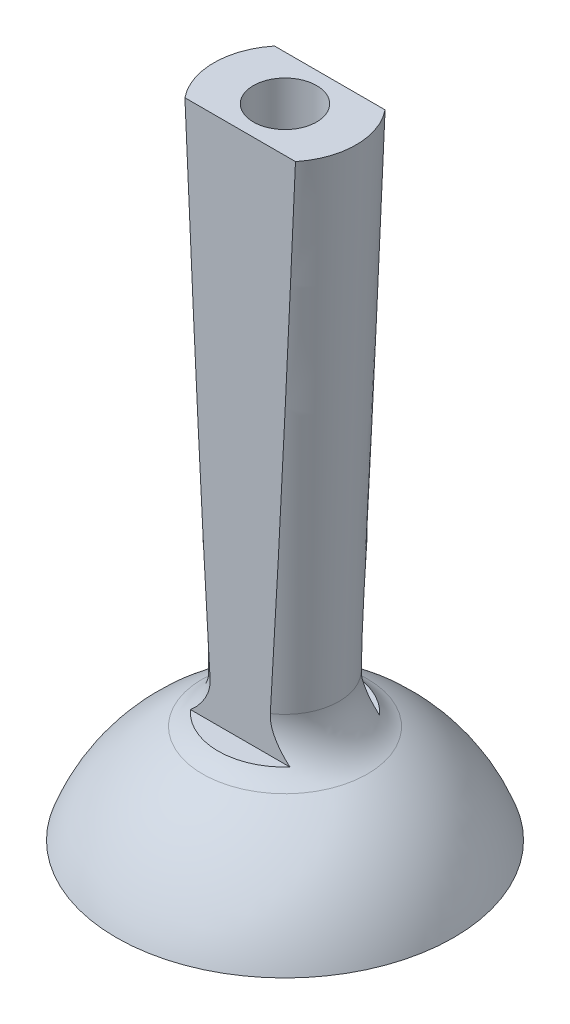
SolidWorks part; units mm, degrees
ref_plane "Спереди" through (0, 0, 0) normal (0, 0, 1) x (1, 0, 0)
ref_plane "Сверху" through (0, 0, 0) normal (0, 1, 0) x (1, 0, 0)
ref_plane "Справа" through (0, 0, 0) normal (1, 0, 0) x (0, 0, -1)
sketch "Эскиз1" plane through (0, 0, 0) normal (0, 0, 1) x (1, 0, 0)
  line L19 (-13.5, 90) -> (-10, -10)
  line L26 (-13.5, 90) -> (-6, 90)
  line L31 (-6, -8.9374) -> (-6, 90)
  line L32 (-32, -31) -> (-27, -31)
  line L33 (-6, -8.9374) -> (-6, -13.7874)
  line L34 (-27, -31) -> (-26.9845, -31)
  line L35 (0, 0) -> (0, 38.8635) construction
  arc A3 (-10, -10) -> (-32, -31) centre (0, -42.5) ccw
  arc A6 (-6, -13.7874) -> (-26.9845, -31) centre (0, -42.5) ccw
revolve "Повернуть1" add sketch "Эскиз1" angle 360 about L35
fillet "Скругление2" radius 10 1 edges at (0, -10, -10)
sketch "Эскиз2" plane through (0, 90, 0) normal (0, 1, 0) x (1, 0, 0)
  line L0 (0, 8.5) -> (19.6139, 8.5)
  line L1 (0, 0) -> (-21.4037, 0) construction
  line L2 (19.6139, 8.5) -> (19.6139, 16.0191)
  line L3 (19.6139, 16.0191) -> (-21.4037, 16.0191)
  line L4 (-21.4037, 16.0191) -> (-21.4037, 8.5)
  line L5 (-21.4037, 8.5) -> (0, 8.5)
  line L6 (-21.4037, -16.0191) -> (-21.4037, -8.5)
  line L7 (19.6139, -16.0191) -> (-21.4037, -16.0191)
  line L8 (19.6139, -8.5) -> (19.6139, -16.0191)
  line L9 (0, -8.5) -> (19.6139, -8.5)
  line L10 (-21.4037, -8.5) -> (0, -8.5)
  point P2 (0, 0)
extrude "Вырез-Вытянуть1" cut sketch "Эскиз2" against normal blind 100
